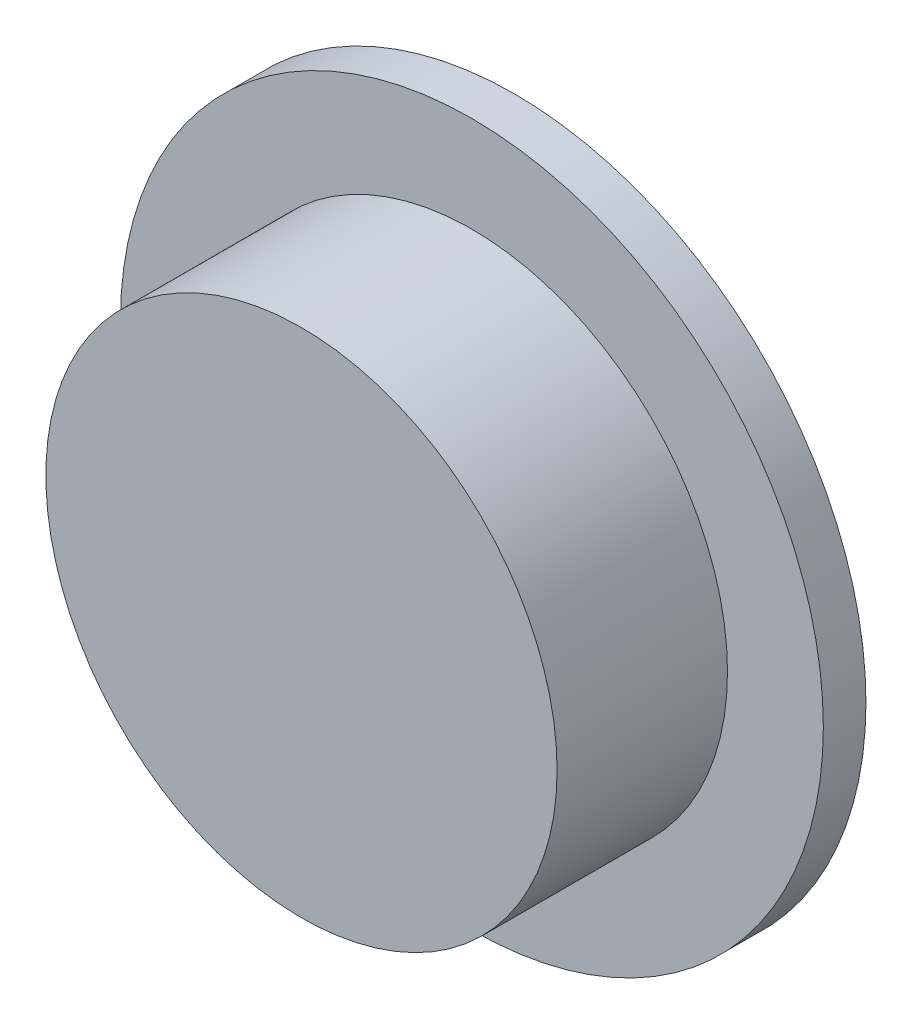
SolidWorks part; units mm, degrees
ref_plane "Ön Düzlem" through (0, 0, 0) normal (0, 0, 1) x (1, 0, 0)
ref_plane "Üst Düzlem" through (0, 0, 0) normal (0, 1, 0) x (1, 0, 0)
ref_plane "Sağ Düzlem" through (0, 0, 0) normal (1, 0, 0) x (0, 0, -1)
sketch "Sketch2" plane through (0, 0, 0) normal (0, 0, 1) x (1, 0, 0)
  circle A0 centre (0, 0) radius 16.5
  dimension "D1" = 33
extrude "Boss-Extrude1" add sketch "Sketch2" along normal blind 2
sketch "Sketch3" plane through (0, 0, 2) normal (0, 0, 1) x (1, 0, 0)
  circle A0 centre (0, 0) radius 12
  dimension "D1" = 24
extrude "Boss-Extrude2" add sketch "Sketch3" along normal blind 8 and the other way blind 4
hole_wizard "Hole1" positions "Sketch4" profile "Sketch5" legacy
sketch "Sketch4" plane through (0, 0, -2) normal (0, 0, -1) x (-1, 0, 0)
  point P0 (0, 0)
sketch "Sketch5" plane through (0, 0, -2) normal (1, 0, 0) x (0, 1, 0)
  line L0 (0, 0) -> (0, 6.9999)
  line L1 (0, 6.9999) -> (6, 6.9999)
  line L2 (6, 6.9999) -> (6, 1)
  line L3 (6, 1) -> (8, 1)
  line L4 (8, 1) -> (8, 0)
  line L5 (8, 0) -> (0, 0)
  line L6 (0, 110) -> (0, -10) construction
  dimension "Diameter" = 12
  dimension "Depth" = 7.28
  dimension "C-Bore Diameter" = 16
  dimension "C-Bore Depth" = 1
